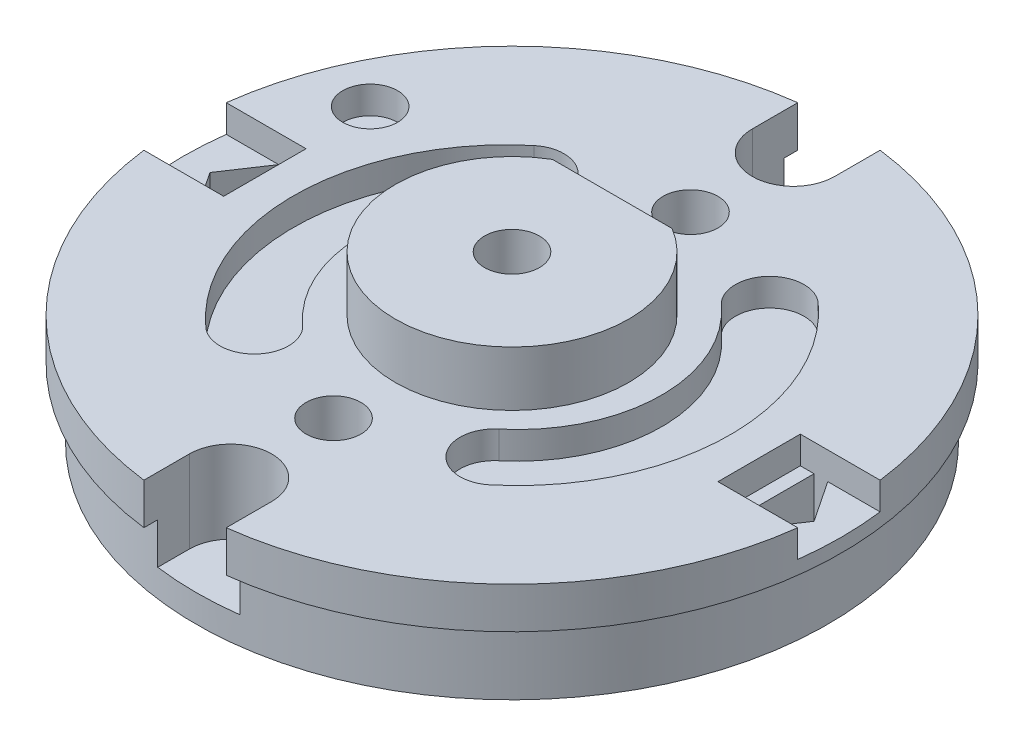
SolidWorks part; units mm, degrees
ref_plane "Plan de face" through (0, 0, 0) normal (0, 0, 1) x (1, 0, 0)
ref_plane "Plan de dessus" through (0, 0, 0) normal (0, 1, 0) x (1, 0, 0)
ref_plane "Plan de droite" through (0, 0, 0) normal (1, 0, 0) x (0, 0, -1)
sketch "Esquisse1" plane through (0, 0, 0) normal (0, 0, 1) x (1, 0, 0)
  line L0 (0, 0) -> (0, 19.6756) construction
  line L1 (-8.5, 0) -> (-8.5, 2.5)
  line L2 (-8.5, 2.5) -> (-1, 2.5)
  line L3 (-1, 2.5) -> (-1, 6)
  line L4 (-1, 6) -> (-4.25, 6)
  line L5 (-4.25, 6) -> (-4.25, 4)
  line L6 (-4.25, 4) -> (-12, 4)
  line L7 (-12, 4) -> (-12, 2.5)
  line L8 (-12, 2.5) -> (-11.5, 2.5)
  line L9 (-11.5, 2.5) -> (-11.5, 0)
  line L11 (-8.5, 0) -> (-11.5, 0)
  dimension "D1" = 2
  dimension "D2" = 8.5
  dimension "D3" = 24
  dimension "D4" = 2
  dimension "D5" = 17
  dimension "D6" = 1.5
  dimension "D7" = 2.5
  dimension "D8" = 2.5
  dimension "D9" = 23
revolve "Révolution1" add sketch "Esquisse1" angle 360 about L0
sketch "Esquisse2" plane through (0, 0, 0) normal (0, 1, 0) x (1, 0, 0)
  circle A0 centre (0, 6.5) radius 1
  point P0 (0, 6.5)
  dimension "D2" = 2
  dimension "D1" = 6.5
extrude "Enlèv. mat.-Extru.2" cut sketch "Esquisse2" along normal through all
sketch "Esquisse6" plane through (0, 0, 0) normal (1, 0, 0) x (0, 0, -1)
  line L0 (3.65, 7.3902) -> (3.65, 4)
  line L1 (12, 4) -> (-12, 4) construction
  dimension "D1" = 3.65
extrude "Enlèv. de mat.-Extru.-Mince1" cut sketch "Esquisse6" against normal through all and the other way through all thin
sketch "Esquisse8" plane through (0, 4, 0) normal (0, 1, 0) x (1, 0, 0)
  line L0 (0, 0) -> (-9.7809, 17.2689) construction
  line L1 (0, 0) -> (-10, -17.3205) construction
  arc A0 (-4.9492, 5.7531) -> (-5.1877, -5.9635) centre (0.0028, -0.2084) ccw
  arc A1 (-3.3518, 3.83) -> (-3.5133, -4.107) centre (0.0028, -0.2084) ccw
  arc A2 (-4.9492, 5.7531) -> (-3.3518, 3.83) centre (-4.1505, 4.7916) cw
  arc A3 (-3.5133, -4.107) -> (-5.1877, -5.9635) centre (-4.3505, -5.0353) cw
  dimension "D1" = 2.5
extrude "Enlèv. mat.-Extru.6" cut sketch "Esquisse8" against normal blind 1
sketch "Esquisse9" plane through (0, 4, 0) normal (0, 1, 0) x (1, 0, 0)
  line L0 (-1.5, 10.25) -> (-1.5, 15)
  line L1 (-1.5, 15) -> (1.5, 15)
  line L2 (1.5, 15) -> (1.5, 10.25)
  arc A0 (1.5, 10.25) -> (-1.5, 10.25) centre (0, 10.25) cw
  dimension "D1" = 1.5
  dimension "D2" = 3
  dimension "D3" = 10.25
  dimension "D4" = 15
extrude "Enlèv. mat.-Extru.7" cut sketch "Esquisse9" against normal blind 3
sketch "Esquisse12" plane through (0, 4, 0) normal (0, 1, 0) x (1, 0, 0)
  line L0 (-11, 0) -> (-10, 1.5)
  line L1 (-10, 1.5) -> (-9.5, 1.5)
  line L2 (-9.5, 1.5) -> (-9.5, -1.5)
  line L3 (-9.5, -1.5) -> (-10, -1.5)
  line L4 (-10, -1.5) -> (-11, 0)
  dimension "D1" = 1.5
  dimension "D2" = 3
  dimension "D3" = 1.5
  dimension "D4" = 9.5
  dimension "D5" = 1.5
  dimension "D6" = 0.5
  dimension "D7" = 0.5
extrude "Enlèv. mat.-Extru.8" cut sketch "Esquisse12" against normal through all
sketch "Esquisse13" plane through (0, 4, 0) normal (0, 1, 0) x (1, 0, 0)
  line L1 (-14.4735, 1.5) -> (-9, 1.5)
  line L2 (-14.4735, 1.5) -> (-14.4735, -1.5)
  line L3 (-14.4735, -1.5) -> (-9, -1.5)
  line L4 (-9, 1.5) -> (-9, -1.5)
  dimension "D1" = 3
  dimension "D2" = 1.5
  dimension "D3" = 9
  dimension "D4" = 5.4735
extrude "Enlèv. mat.-Extru.9" cut sketch "Esquisse13" against normal blind 1
sketch "Esquisse14" plane through (0, 4, 0) normal (0, 1, 0) x (1, 0, 0)
  circle A0 centre (-9.1652, 4) radius 1
  point P0 (-9.1652, 4)
  dimension "D1" = 4
  dimension "D2" = 10
extrude "Enlèv. mat.-Extru.10" cut sketch "Esquisse14" against normal blind 1
pattern_circular "Répétition circulaire2" count 2 every 180 about axis through (0, 0, 0) along (0, 1, 0) of "Enlèv. mat.-Extru.9", "Enlèv. mat.-Extru.8", "Enlèv. mat.-Extru.7", "Enlèv. mat.-Extru.6", "Enlèv. mat.-Extru.2"
